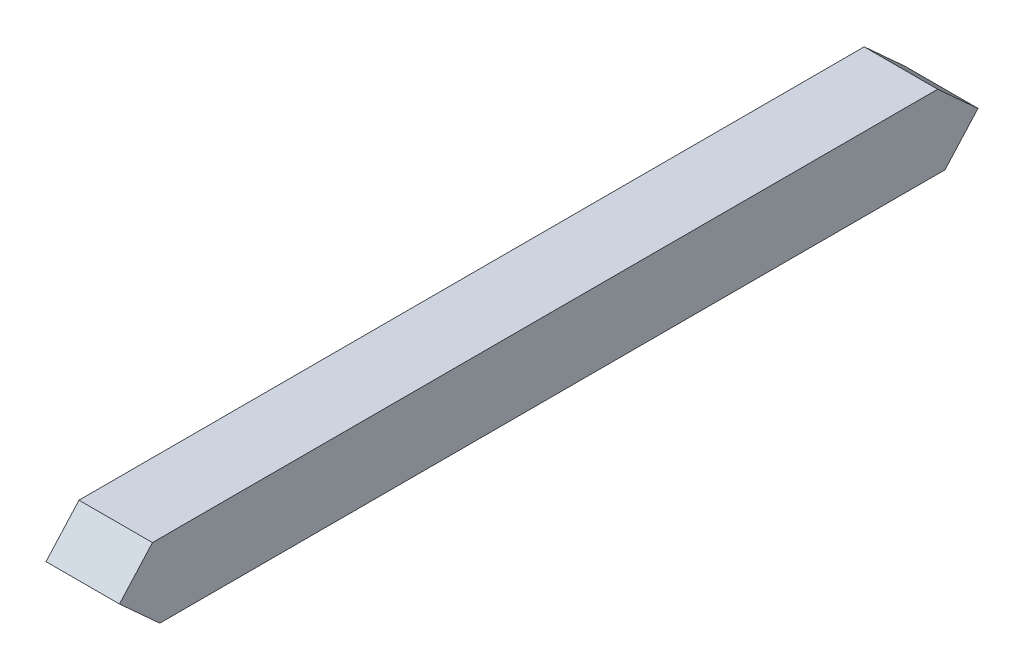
SolidWorks part; units mm, degrees
ref_plane "Plan de face" through (0, 0, 0) normal (0, 0, 1) x (1, 0, 0)
ref_plane "Plan de dessus" through (0, 0, 0) normal (0, 1, 0) x (1, 0, 0)
ref_plane "Plan de droite" through (0, 0, 0) normal (1, 0, 0) x (0, 0, -1)
sketch "Esquisse1" plane through (0, 0, 0) normal (0, 0, 1) x (1, 0, 0)
  line L1 (-33.5, 33.5) -> (33.5, 33.5)
  line L2 (-33.5, 33.5) -> (-33.5, -33.5)
  line L3 (-33.5, -33.5) -> (33.5, -33.5)
  line L4 (33.5, 33.5) -> (33.5, -33.5)
  line L5 (-33.5, 33.5) -> (33.5, -33.5) construction
  line L6 (-33.5, -33.5) -> (33.5, 33.5) construction
  point P0 (0, 0)
  dimension "D1" = 67
  dimension "D2" = 67
extrude "Boss.-Extru.1" add sketch "Esquisse1" along normal blind 783
sketch "Esquisse5" plane through (0, 0, 0) normal (1, 0, 0) x (0, 0, -1)
  line L0 (-783, -33.5) -> (-783, 33.5) construction
  line L1 (-783, 0) -> (-783, -33.5)
  line L2 (-783, 0) -> (-746.222, -33.5)
  line L3 (-783, -33.5) -> (0, -33.5) construction
  line L4 (-746.222, -33.5) -> (-783, -33.5)
  line L5 (-783, 0) -> (-752.914, 33.5)
  line L6 (-783, 33.5) -> (0, 33.5) construction
  line L7 (-752.914, 33.5) -> (-783, 33.5)
  line L8 (-783, 33.5) -> (-783, 0)
  line L9 (-30.086, -33.5) -> (0, -33.5)
  line L10 (0, 0) -> (-30.086, -33.5)
  line L11 (0, -33.5) -> (0, 0)
  line L12 (0, 0) -> (0, 33.5)
  line L13 (0, 0) -> (-36.778, 33.5)
  line L14 (-36.778, 33.5) -> (0, 33.5)
  arc A0 (-783, 28.0967) -> (-764.1268, 20.8142) centre (-783, 0) cw
  point P0 (-783, 0)
  point P6 (-391.5, 33.5)
  point P17 (-391.5, 0)
  point P26 (-391.5, 0)
  dimension "D1" = 2
extrude "Enlèv. mat.-Extru.2" cut sketch "Esquisse5" against normal through all both and the other way through all contours L5 L7 L8 | L2 L4 L1 | L10 L9 L11 | L13 L14 L12
